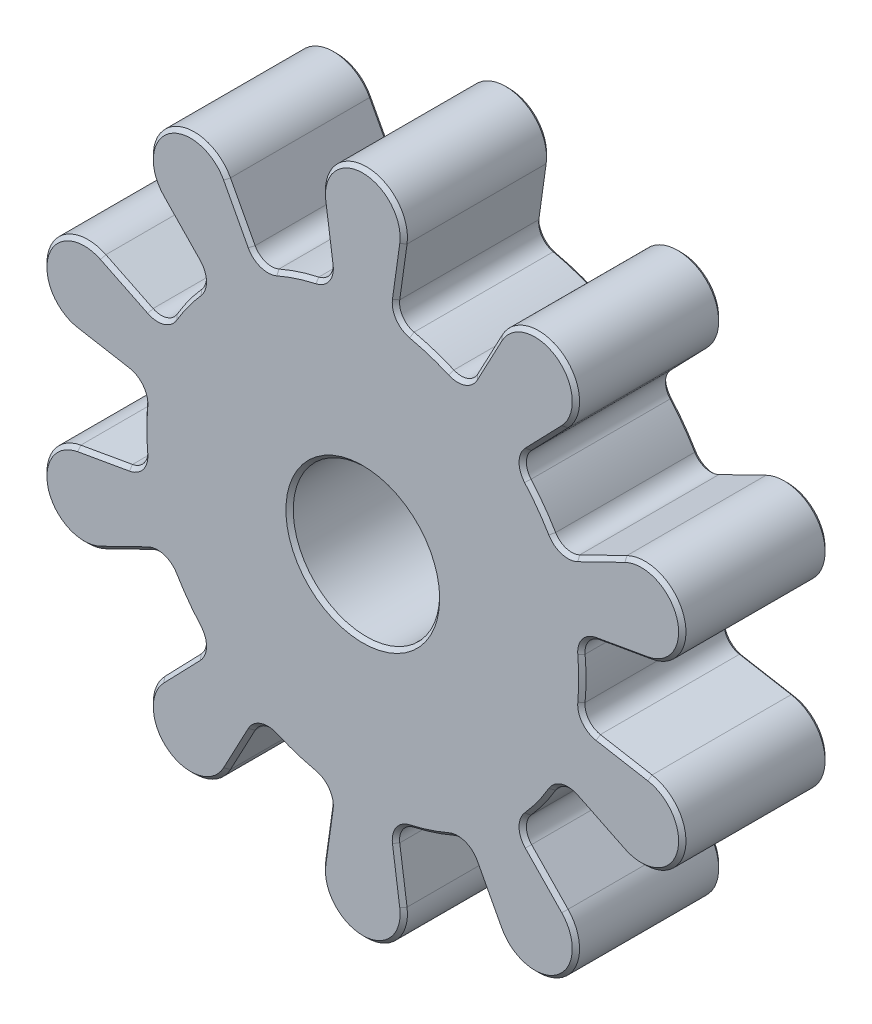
SolidWorks part; units mm, degrees
ref_plane "Спереди" through (0, 0, 0) normal (0, 0, 1) x (1, 0, 0)
ref_plane "Сверху" through (0, 0, 0) normal (0, 1, 0) x (1, 0, 0)
ref_plane "Справа" through (0, 0, 0) normal (1, 0, 0) x (0, 0, -1)
sketch "Эскиз1" plane through (0, 0, 0) normal (0, 0, 1) x (1, 0, 0)
  line L0 (0, 0) -> (0, 20) construction
  line L1 (7.5998, 14.3283) -> (9.2835, 17.4949)
  line L2 (2.2736, 16.0589) -> (2.7728, 19.6103)
  line L3 (-2.2736, 16.0589) -> (-2.7728, 19.6103)
  line L4 (11.2786, 11.6555) -> (13.7699, 14.2353)
  line L5 (14.5703, 7.1248) -> (17.7937, 8.697)
  line L6 (15.9755, 2.8001) -> (19.5073, 3.4229)
  line L7 (15.9755, -2.8001) -> (19.5073, -3.4229)
  line L8 (14.5703, -7.1248) -> (17.7937, -8.697)
  line L9 (11.2786, -11.6555) -> (13.7699, -14.2353)
  line L10 (7.5998, -14.3283) -> (9.2835, -17.4949)
  line L11 (2.2736, -16.0589) -> (2.7728, -19.6103)
  line L12 (-2.2736, -16.0589) -> (-2.7728, -19.6103)
  line L13 (-7.5998, -14.3283) -> (-9.2835, -17.4949)
  line L14 (-11.2786, -11.6555) -> (-13.7699, -14.2353)
  line L15 (-14.5703, -7.1248) -> (-17.7937, -8.697)
  line L16 (-15.9755, -2.8001) -> (-19.5073, -3.4229)
  line L17 (-15.9755, 2.8001) -> (-19.5073, 3.4229)
  line L18 (-14.5703, 7.1248) -> (-17.7937, 8.697)
  line L19 (-11.2786, 11.6555) -> (-13.7699, 14.2353)
  line L20 (-7.5998, 14.3283) -> (-9.2835, 17.4949)
  circle A0 centre (0, 0) radius 5
  circle A1 centre (0, 0) radius 20 construction
  arc A2 (-3.2556, 14.6424) -> (-5.9727, 13.7596) centre (0, 0) ccw
  arc A3 (2.7728, 19.6103) -> (-2.7728, 19.6103) centre (0, 20) ccw
  arc A4 (2.2736, 16.0589) -> (3.2556, 14.6424) centre (3.5313, 15.8822) ccw
  arc A5 (-2.2736, 16.0589) -> (-3.2556, 14.6424) centre (-3.5313, 15.8822) cw
  arc A6 (7.5998, 14.3283) -> (5.9727, 13.7596) centre (6.4784, 14.9246) cw
  arc A7 (13.7699, 14.2353) -> (9.2835, 17.4949) centre (11.7557, 16.1803) ccw
  arc A8 (11.2786, 11.6555) -> (11.2405, 9.9324) centre (12.1922, 10.7733) ccw
  arc A9 (14.5703, 7.1248) -> (12.9197, 7.621) centre (14.0136, 8.2663) cw
  arc A10 (19.5073, 3.4229) -> (17.7937, 8.697) centre (19.0211, 6.1803) ccw
  arc A11 (15.9755, 2.8001) -> (14.9318, 1.4285) centre (16.1961, 1.5494) ccw
  arc A12 (15.9755, -2.8001) -> (14.9318, -1.4285) centre (16.1961, -1.5494) cw
  arc A13 (17.7937, -8.697) -> (19.5073, -3.4229) centre (19.0211, -6.1803) ccw
  arc A14 (14.5703, -7.1248) -> (12.9197, -7.621) centre (14.0136, -8.2663) ccw
  arc A15 (11.2786, -11.6555) -> (11.2405, -9.9324) centre (12.1922, -10.7733) cw
  arc A16 (9.2835, -17.4949) -> (13.7699, -14.2353) centre (11.7557, -16.1803) ccw
  arc A17 (7.5998, -14.3283) -> (5.9727, -13.7596) centre (6.4784, -14.9246) ccw
  arc A18 (2.2736, -16.0589) -> (3.2556, -14.6424) centre (3.5313, -15.8822) cw
  arc A19 (-2.7728, -19.6103) -> (2.7728, -19.6103) centre (0, -20) ccw
  arc A20 (-2.2736, -16.0589) -> (-3.2556, -14.6424) centre (-3.5313, -15.8822) ccw
  arc A21 (-7.5998, -14.3283) -> (-5.9727, -13.7596) centre (-6.4784, -14.9246) cw
  arc A22 (-13.7699, -14.2353) -> (-9.2835, -17.4949) centre (-11.7557, -16.1803) ccw
  arc A23 (-11.2786, -11.6555) -> (-11.2405, -9.9324) centre (-12.1922, -10.7733) ccw
  arc A24 (-14.5703, -7.1248) -> (-12.9197, -7.621) centre (-14.0136, -8.2663) cw
  arc A25 (-19.5073, -3.4229) -> (-17.7937, -8.697) centre (-19.0211, -6.1803) ccw
  arc A26 (-15.9755, -2.8001) -> (-14.9318, -1.4285) centre (-16.1961, -1.5494) ccw
  arc A27 (-15.9755, 2.8001) -> (-14.9318, 1.4285) centre (-16.1961, 1.5494) cw
  arc A28 (-17.7937, 8.697) -> (-19.5073, 3.4229) centre (-19.0211, 6.1803) ccw
  arc A29 (-14.5703, 7.1248) -> (-12.9197, 7.621) centre (-14.0136, 8.2663) ccw
  arc A30 (-11.2786, 11.6555) -> (-11.2405, 9.9324) centre (-12.1922, 10.7733) cw
  arc A31 (-9.2835, 17.4949) -> (-13.7699, 14.2353) centre (-11.7557, 16.1803) ccw
  arc A32 (-7.5998, 14.3283) -> (-5.9727, 13.7596) centre (-6.4784, 14.9246) ccw
  arc A33 (5.9727, 13.7596) -> (3.2556, 14.6424) centre (0, 0) ccw
  arc A34 (12.9197, 7.621) -> (11.2405, 9.9324) centre (0, 0) ccw
  arc A35 (-11.2405, 9.9324) -> (-12.9197, 7.621) centre (0, 0) ccw
  arc A36 (-14.9318, 1.4285) -> (-14.9318, -1.4285) centre (0, 0) ccw
  arc A37 (-12.9197, -7.621) -> (-11.2405, -9.9324) centre (0, 0) ccw
  arc A38 (14.9318, -1.4285) -> (14.9318, 1.4285) centre (0, 0) ccw
  arc A39 (-5.9727, -13.7596) -> (-3.2556, -14.6424) centre (0, 0) ccw
  arc A40 (3.2556, -14.6424) -> (5.9727, -13.7596) centre (0, 0) ccw
  arc A41 (11.2405, -9.9324) -> (12.9197, -7.621) centre (0, 0) ccw
  dimension "D1" = 10
  dimension "D2" = 40
  dimension "D3" = 30
  dimension "D4" = 5.6
  dimension "D7" = 1.27
  dimension "D5" = 16
  dimension "D6" = 8
  dimension "D8" = 10
extrude "Бобышка-Вытянуть1" add sketch "Эскиз1" along normal blind 10
chamfer "Фаска1" distance 0.25 angle 45 122 edges at (5, 0, 0) (2.5232, 17.8346, 0) (0, 22.8, 0) (-2.5232, 17.8346, 0) (-2.4876, 15.1586, 0) (-4.6353, 14.2658, 0) (-6.8975, 13.7257, 0) (-8.4416, 15.9116, 0) (-13.4015, 18.4456, 0) (-12.5242, 12.9454, 0) (-10.9225, 10.8014, 0) (-12.1353, 8.8168, 0) (-13.648, 7.0501, 0) (-16.182, 7.9109, 0) (-21.6841, 7.0456, 0) (-17.7414, 3.1115, 0) (-15.1854, 2.3185, 0) (-15, 0, 0) (-15.1854, -2.3185, 0) (-17.7414, -3.1115, 0) (-21.6841, -7.0456, 0) (-16.182, -7.9109, 0) (-13.648, -7.0501, 0) (-12.1353, -8.8168, 0) (-10.9225, -10.8014, 0) (-12.5242, -12.9454, 0) (-13.4015, -18.4456, 0) (-8.4416, -15.9116, 0) (-6.8975, -13.7257, 0) (-4.6353, -14.2658, 0) (-2.4876, -15.1586, 0) (-2.5232, -17.8346, 0) (0, -22.8, 0) (2.5232, -17.8346, 0) (2.4876, -15.1586, 0) (4.6353, -14.2658, 0) (6.8975, -13.7257, 0) (8.4416, -15.9116, 0) (13.4015, -18.4456, 0) (12.5242, -12.9454, 0) (10.9225, -10.8014, 0) (12.1353, -8.8168, 0) (13.648, -7.0501, 0) (16.182, -7.9109, 0) (21.6841, -7.0456, 0) (17.7414, -3.1115, 0) (15.1854, -2.3185, 0) (15, 0, 0) (15.1854, 2.3185, 0) (17.7414, 3.1115, 0) (21.6841, 7.0456, 0) (16.182, 7.9109, 0) (13.648, 7.0501, 0) (12.1353, 8.8168, 0) (10.9225, 10.8014, 0) (12.5242, 12.9454, 0) (13.4015, 18.4456, 0) (8.4416, 15.9116, 0) (6.8975, 13.7257, 0) (4.6353, 14.2658, 0) (2.4876, 15.1586, 0) (5, 0, 10) (4.6353, 14.2658, 10) (6.8975, 13.7257, 10) (8.4416, 15.9116, 10) (13.4015, 18.4456, 10) (12.5242, 12.9454, 10) (10.9225, 10.8014, 10) (12.1353, 8.8168, 10) (13.648, 7.0501, 10) (16.182, 7.9109, 10) (21.6841, 7.0456, 10) (17.7414, 3.1115, 10) (15.1854, 2.3185, 10) (15, 0, 10) (15.1854, -2.3185, 10) (17.7414, -3.1115, 10) (21.6841, -7.0456, 10) (16.182, -7.9109, 10) (13.648, -7.0501, 10) (12.1353, -8.8168, 10) (10.9225, -10.8014, 10) (12.5242, -12.9454, 10) (13.4015, -18.4456, 10) (8.4416, -15.9116, 10) (6.8975, -13.7257, 10) (4.6353, -14.2658, 10) (2.4876, -15.1586, 10) (2.5232, -17.8346, 10) (0, -22.8, 10) (-2.5232, -17.8346, 10) (-2.4876, -15.1586, 10) (-4.6353, -14.2658, 10) (-6.8975, -13.7257, 10) (-8.4416, -15.9116, 10) (-13.4015, -18.4456, 10) (-12.5242, -12.9454, 10) (-10.9225, -10.8014, 10) (-12.1353, -8.8168, 10) (-13.648, -7.0501, 10) (-16.182, -7.9109, 10) (-21.6841, -7.0456, 10) (-17.7414, -3.1115, 10) (-15.1854, -2.3185, 10) (-15, 0, 10) (-15.1854, 2.3185, 10) (-17.7414, 3.1115, 10) (-21.6841, 7.0456, 10) (-16.182, 7.9109, 10) (-13.648, 7.0501, 10) (-12.1353, 8.8168, 10) (-10.9225, 10.8014, 10) (-12.5242, 12.9454, 10) (-13.4015, 18.4456, 10) (-8.4416, 15.9116, 10) (-6.8975, 13.7257, 10) (-4.6353, 14.2658, 10) (-2.4876, 15.1586, 10) (-2.5232, 17.8346, 10) (0, 22.8, 10) (2.5232, 17.8346, 10) (2.4876, 15.1586, 10)
